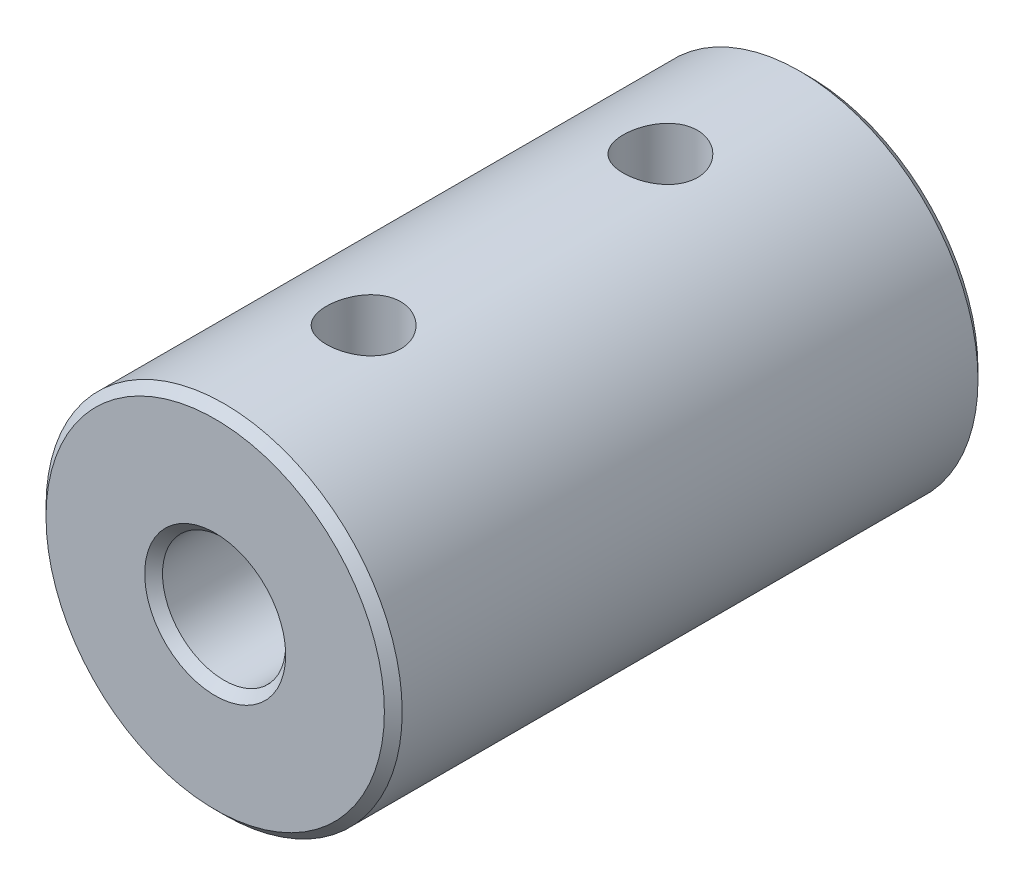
SolidWorks part; units mm, degrees
ref_plane "Plan de face" through (0, 0, 0) normal (0, 0, 1) x (1, 0, 0)
ref_plane "Plan de dessus" through (0, 0, 0) normal (0, 1, 0) x (1, 0, 0)
ref_plane "Plan de droite" through (0, 0, 0) normal (1, 0, 0) x (0, 0, -1)
sketch "Esquisse1" plane through (0, 0, 0) normal (0, 0, 1) x (1, 0, 0)
  circle A0 centre (0, 0) radius 6
  circle A1 centre (0, 0) radius 1.575
extrude "Boss.-Extru.1" add sketch "Esquisse1" along normal mid plane 20
sketch "Esquisse2" plane through (0, 0, 10) normal (0, 0, 1) x (1, 0, 0)
  circle A0 centre (0, 0) radius 2.075
extrude "Enlèv. mat.-Extru.1" cut sketch "Esquisse2" against normal blind 10
ref_plane "Plan1" through (0, 0, 0) normal (0, 1, 0) x (-1, 0, 0)
sketch "Esquisse3" plane through (0, 0, 0) normal (0, 1, 0) x (-1, 0, 0)
  line L0 (0, -2.4446) -> (0, 9.3829) construction
  line L1 (-5.1223, 0) -> (1.4849, 0) construction
  line L2 (-5.1223, 5) -> (1.4849, 5) construction
  circle A0 centre (0, 5) radius 1.25
  circle A1 centre (0, -5) radius 1.25
  dimension "D1" = 5
extrude "Enlèv. mat.-Extru.2" cut sketch "Esquisse3" against normal mid plane 12
chamfer "Chanfrein1" distance 0.3 angle 45 4 edges at (6, 0, -10) (1.575, 0, -10) (2.075, 0, 10) (6, 0, 10)
